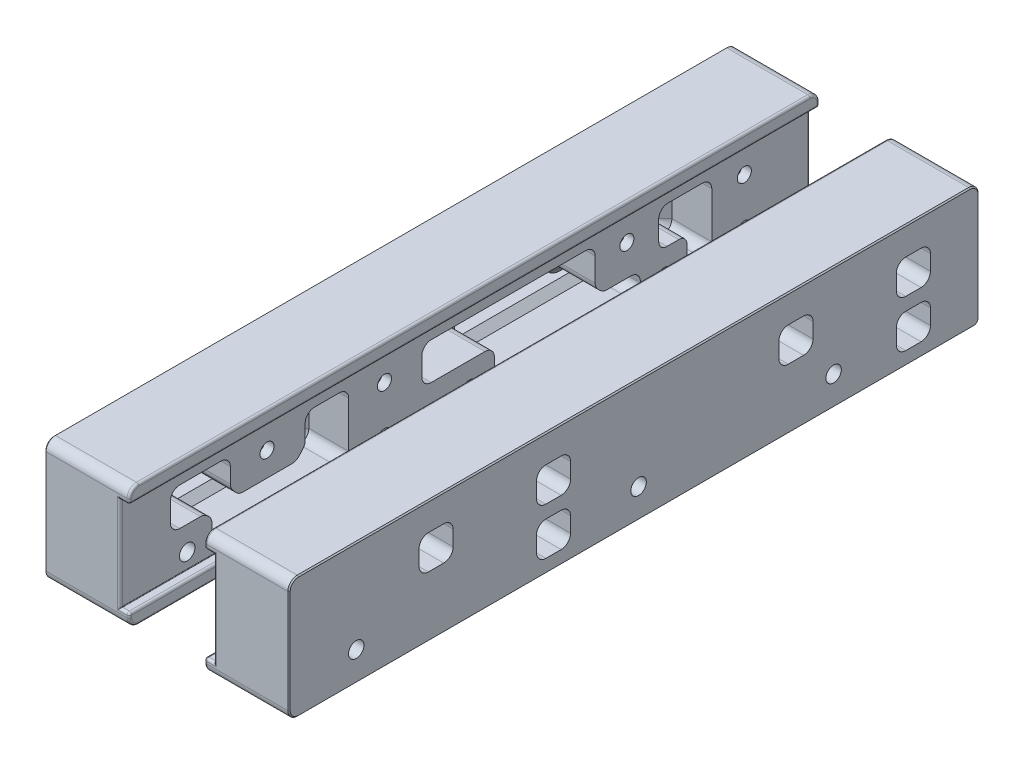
SolidWorks part; units mm, degrees
ref_plane "Спереди" through (0, 0, 0) normal (0, 0, 1) x (1, 0, 0)
ref_plane "Сверху" through (0, 0, 0) normal (0, 1, 0) x (1, 0, 0)
ref_plane "Справа" through (0, 0, 0) normal (1, 0, 0) x (0, 0, -1)
sketch "Эскиз2" plane through (0, 0, 0) normal (0, 0, 1) x (1, 0, 0)
  line L0 (0, 0) -> (22.3224, 0) construction
  line L1 (0, -10) -> (0, 10)
  line L2 (0, 10) -> (2, 10)
  line L3 (0, -10) -> (2, -10)
  line L4 (2, 10) -> (2, 13)
  line L5 (2, -10) -> (2, -13)
  line L6 (2, 13) -> (-15.99, 13)
  line L7 (2, -13) -> (-15.99, -13)
  line L8 (-15.99, 13) -> (-15.99, 0)
  line L9 (-15.99, 0) -> (-15.99, -13)
  line L10 (34.925, -34.3321) -> (34.925, 29.1374) construction
  point P6 (0, 0)
  dimension "D1" = 26
  dimension "D2" = 50.915
  dimension "D3" = 34.925
  dimension "D4" = 20
  dimension "D5" = 3
  dimension "D6" = 15.99
extrude "Бобышка-Вытянуть1" add sketch "Эскиз2" along normal blind 146.9
sketch "Эскиз3" plane through (0, 0, 0) normal (1, 0, 0) x (0, 0, -1)
  line L0 (0, 0) -> (12.8936, 0) construction
  line L1 (-14, 7.6777) -> (-14, -7.642) construction
  line L2 (-18.1695, 3.5) -> (16.6858, 3.5) construction
  line L3 (4.8407, -6.5) -> (24.6138, -6.5) construction
  line L4 (-146.9, -10) -> (0, -10) construction
  line L5 (-146.9, 10) -> (0, 10) construction
  line L6 (-146.9, 10) -> (0, 10) construction
  line L7 (-146.9, -10) -> (0, -10) construction
  line L8 (-90.6, 7.6777) -> (-90.6, -7.642) construction
  line L9 (0, -10) -> (0, 10) construction
  line L10 (-30.99, 25.1657) -> (-30.99, -20.7809) construction
  line L11 (-132.59, 25.1657) -> (-132.59, -20.7809) construction
  line L12 (-39, 0) -> (-39, 11.712) construction
  line L13 (6.8452, -6.75) -> (-42.5956, -6.75) construction
  line L14 (-146.9, -13) -> (0, -13) construction
  line L15 (-72.5, 25.1657) -> (-72.5, -20.7809) construction
  line L16 (-115.6, 0) -> (-115.6, 11.712) construction
  circle A0 centre (-14, 3.5) radius 1.5
  circle A1 centre (-14, -6.5) radius 1.5
  circle A2 centre (-90.6, 3.5) radius 1.5
  circle A3 centre (-90.6, -6.5) radius 1.5
  circle A4 centre (-30.99, -6.75) radius 1.65
  circle A5 centre (-132.59, -6.75) radius 1.65
  circle A6 centre (-72.5, -6.75) radius 1.65
  circle A7 centre (-39, 3.5) radius 1.5
  circle A8 centre (-115.6, 3.5) radius 1.5
  point P53 (0, 0)
  point P54 (0, 0)
  dimension "D8" = 90.6
  dimension "D9" = 30.99
  dimension "D11" = 41.51
  dimension "D13" = 25
  dimension "D1" = 14
  dimension "D2" = 3.5
  dimension "D3" = 3.5
  dimension "D4" = 6.5
  dimension "D5" = 6.5
  dimension "D6" = 10
  dimension "D7" = 10
  dimension "D10" = 6.25
  dimension "D12" = 101.6
  dimension "D14" = 25
extrude "Вырез-Вытянуть1" cut sketch "Эскиз3" against normal blind 2
sketch "Эскиз4" plane through (-15.99, 0, 0) normal (-1, 0, 0) x (0, 0, 1)
  line L1 (10.375, -0.125) -> (17.625, -0.125)
  line L2 (10.375, -0.125) -> (10.375, 7.125)
  line L3 (10.375, 7.125) -> (17.625, 7.125)
  line L4 (17.625, -0.125) -> (17.625, 7.125)
  line L5 (10.375, -0.125) -> (17.625, 7.125) construction
  line L6 (10.375, 7.125) -> (17.625, -0.125) construction
  line L11 (10.375, -10.125) -> (17.625, -10.125)
  line L12 (10.375, -10.125) -> (10.375, -2.875)
  line L13 (10.375, -2.875) -> (17.625, -2.875)
  line L14 (17.625, -10.125) -> (17.625, -2.875)
  line L15 (10.375, -10.125) -> (17.625, -2.875) construction
  line L16 (10.375, -2.875) -> (17.625, -10.125) construction
  line L17 (86.975, -0.125) -> (94.225, -0.125)
  line L18 (86.975, -0.125) -> (86.975, 7.125)
  line L19 (86.975, 7.125) -> (94.225, 7.125)
  line L20 (94.225, -0.125) -> (94.225, 7.125)
  line L21 (86.975, -0.125) -> (94.225, 7.125) construction
  line L22 (86.975, 7.125) -> (94.225, -0.125) construction
  line L23 (86.975, -10.125) -> (94.225, -10.125)
  line L24 (86.975, -10.125) -> (86.975, -2.875)
  line L25 (86.975, -2.875) -> (94.225, -2.875)
  line L26 (94.225, -10.125) -> (94.225, -2.875)
  line L27 (86.975, -10.125) -> (94.225, -2.875) construction
  line L28 (86.975, -2.875) -> (94.225, -10.125) construction
  line L29 (35.375, -0.125) -> (42.625, -0.125)
  line L30 (35.375, -0.125) -> (35.375, 7.125)
  line L31 (35.375, 7.125) -> (42.625, 7.125)
  line L32 (42.625, -0.125) -> (42.625, 7.125)
  line L33 (35.375, -0.125) -> (42.625, 7.125) construction
  line L34 (35.375, 7.125) -> (42.625, -0.125) construction
  line L35 (111.975, -0.125) -> (119.225, -0.125)
  line L36 (111.975, -0.125) -> (111.975, 7.125)
  line L37 (111.975, 7.125) -> (119.225, 7.125)
  line L38 (119.225, -0.125) -> (119.225, 7.125)
  line L39 (111.975, -0.125) -> (119.225, 7.125) construction
  line L40 (111.975, 7.125) -> (119.225, -0.125) construction
  circle A0 centre (90.6, -6.5) radius 1.5 construction
  circle A1 centre (90.6, 3.5) radius 1.5 construction
  circle A2 centre (14, -6.5) radius 1.5 construction
  circle A3 centre (14, 3.5) radius 1.5 construction
  circle A4 centre (90.6, -6.5) radius 1.5 construction
  circle A5 centre (90.6, 3.5) radius 1.5 construction
  circle A6 centre (14, -6.5) radius 1.5 construction
  circle A7 centre (14, 3.5) radius 1.5 construction
  circle A8 centre (115.6, 3.5) radius 1.5 construction
  circle A9 centre (39, 3.5) radius 1.5 construction
  circle A10 centre (115.6, 3.5) radius 1.5 construction
  circle A11 centre (39, 3.5) radius 1.5 construction
  dimension "D1" = 7.25
extrude "Вырез-Вытянуть2" cut sketch "Эскиз4" against normal offset from surface (13.79 mm away) 0.2
fillet "Скругление2" radius 2 24 edges at (-9.095, -0.125, 10.375) (-9.095, -0.125, 17.625) (-9.095, 7.125, 10.375) (-9.095, -10.125, 86.975) (-9.095, -10.125, 94.225) (-9.095, -2.875, 94.225) (-9.095, -2.875, 86.975) (-9.095, -10.125, 10.375) (-9.095, -10.125, 17.625) (-9.095, -2.875, 17.625) (-9.095, -2.875, 10.375) (-9.095, -0.125, 86.975) (-9.095, -0.125, 94.225) (-9.095, 7.125, 94.225) (-9.095, 7.125, 86.975) (-9.095, 7.125, 17.625) (-9.095, -0.125, 35.375) (-9.095, -0.125, 42.625) (-9.095, 7.125, 42.625) (-9.095, 7.125, 35.375) (-9.095, -0.125, 111.975) (-9.095, -0.125, 119.225) (-9.095, 7.125, 119.225) (-9.095, 7.125, 111.975)
sketch "Эскиз5" plane through (-15.99, 0, 0) normal (-1, 0, 0) x (0, 0, 1)
  circle A0 centre (30.99, -6.75) radius 1.65 construction
  circle A1 centre (72.5, -6.75) radius 1.65 construction
  circle A2 centre (132.59, -6.75) radius 1.65 construction
  circle A3 centre (30.99, -6.75) radius 1.65
  circle A4 centre (72.5, -6.75) radius 1.65
  circle A5 centre (132.59, -6.75) radius 1.65
extrude "Вырез-Вытянуть3" cut sketch "Эскиз5" against normal through all
sketch "Эскиз6" plane through (0, 0, 0) normal (1, 0, 0) x (0, 0, -1)
  line L0 (-136.1688, 6.3867) -> (-123.3982, 6.3867)
  line L1 (-98.2072, 6.3867) -> (-98.2072, -7.4091)
  line L2 (-98.2072, -7.4091) -> (-127.3311, -7.4091)
  line L3 (-127.3311, -7.4091) -> (-127.3311, -3.0996)
  line L4 (-129.0166, -1.6497) -> (-136.1688, -1.6497)
  line L5 (-136.1688, -1.6497) -> (-136.1688, 6.3867)
  line L6 (-82.6461, 6.3867) -> (-82.6461, -1.4975)
  line L9 (-77.7965, -1.4975) -> (-67.2015, -1.4975)
  line L10 (-67.2015, -1.4975) -> (-67.2015, -7.4091)
  line L11 (-67.2015, -7.4091) -> (-36.1358, -7.4091)
  line L12 (-36.1358, -7.4091) -> (-36.1358, -4.8542)
  line L13 (-31.1328, -1.4975) -> (-27.2462, -1.4975)
  line L14 (-26.1782, -2.3537) -> (-26.1782, -7.4091)
  line L15 (-26.1782, -7.4091) -> (-20.9241, -7.4091)
  line L16 (-20.9241, -7.4091) -> (-20.9241, 6.3867)
  line L17 (-20.9241, 6.3867) -> (-32.2251, 6.3867)
  line L18 (-45.7507, 6.3867) -> (-45.7507, -1.4975)
  line L19 (-44.0699, -3.0996) -> (-36.4696, -3.0996)
  line L20 (-45.7507, -1.4975) -> (-44.0699, -3.0996)
  line L22 (-32.2251, -0.6525) -> (-32.2251, 6.3867)
  line L23 (-27.2462, -1.4975) -> (-26.1782, -2.3537)
  line L24 (-32.2251, -0.6525) -> (-31.1328, -1.4975)
  line L25 (-45.7507, 6.3867) -> (-82.6461, 6.3867)
  line L29 (-123.3982, 6.3867) -> (-123.3982, 0.4203)
  line L30 (-121.6503, -1.6497) -> (-109.4147, -1.6497)
  line L31 (-107.4794, 0.4203) -> (-107.4794, 6.3867)
  line L32 (-107.4794, 6.3867) -> (-98.2072, 6.3867)
  line L34 (-127.3311, -3.0996) -> (-129.0166, -1.6497)
  line L35 (-121.6503, -1.6497) -> (-123.3982, 0.4203)
  line L36 (-107.4794, 0.4203) -> (-109.4147, -1.6497)
  line L37 (-77.7965, -1.4975) -> (-82.6461, -1.4975)
  line L40 (-36.1358, -4.8542) -> (-36.1358, -3.0996)
  line L41 (-36.1358, -3.0996) -> (-36.4696, -3.0996)
extrude "Вырез-Вытянуть4" cut sketch "Эскиз6" against normal offset from surface (9.99 mm away) 6
fillet "Скругление3" radius 2 30 edges at (-4.995, -1.4975, 67.2015) (-4.995, -7.4091, 67.2015) (-4.995, -7.4091, 36.1358) (-4.995, -7.4091, 26.1782) (-4.995, -7.4091, 20.9241) (-4.995, 6.3867, 20.9241) (-4.995, -7.4091, 127.3311) (-4.995, -7.4091, 98.2072) (-4.995, 6.3867, 136.1688) (-4.995, -1.6497, 136.1688) (-4.995, -1.6497, 129.0166) (-4.995, -3.0996, 127.3311) (-4.995, 6.3867, 98.2072) (-4.995, 6.3867, 107.4794) (-4.995, 0.4203, 107.4794) (-4.995, -1.6497, 109.4147) (-4.995, -1.6497, 121.6503) (-4.995, 0.4203, 123.3982) (-4.995, 6.3867, 123.3982) (-4.995, 6.3867, 32.2251) (-4.995, -2.3537, 26.1782) (-4.995, -1.4975, 27.2462) (-4.995, 6.3867, 82.6461) (-4.995, 6.3867, 45.7507) (-4.995, -1.4975, 45.7507) (-4.995, -3.0996, 44.0699) (-4.995, -1.4975, 82.6461) (-4.995, -0.6525, 32.2251) (-4.995, -1.4975, 31.1328) (-4.995, -3.0996, 36.1358)
fillet "Скругление4" radius 0.25 8 edges at (-15.99, 0, 146.9) (-15.99, -13, 73.45) (-15.99, 0, 0) (-15.99, 13, 73.45) (-6.995, 13, 146.9) (-6.995, -13, 146.9) (-6.995, -13, 0) (-6.995, 13, 0)
sketch "Эскиз9" plane through (0, 0, 0) normal (1, 0, 0) x (0, 0, -1)
  line L1 (-0.25, 13) -> (-146.65, 13) construction
  line L3 (-146.9, 12.75) -> (-146.9, -12.75) construction
  line L5 (-146.65, -13) -> (-0.25, -13) construction
  line L7 (0, -12.75) -> (0, 12.75) construction
  line L9 (-2, 13) -> (-144.9, 13)
  line L11 (-146.9, 11) -> (-146.9, -11)
  line L13 (-144.9, -13) -> (-1.1823, -13)
  line L15 (0, -11.8177) -> (0, 11)
  arc A0 (0, 11) -> (-2, 13) centre (-2, 11) ccw
  arc A1 (-1.1823, -13) -> (0, -11.8177) centre (-1.1823, -11.8177) ccw
  arc A2 (-146.9, -11) -> (-144.9, -13) centre (-144.9, -11) ccw
  arc A3 (-144.9, 13) -> (-146.9, 11) centre (-144.9, 11) ccw
extrude "Вырез-Вытянуть7" cut sketch "Эскиз9" against normal through all both and the other way through all flip side to cut
fillet "Скругление5" radius 0.5 18 edges at (2, -10, 73.45) (2, -10.9089, 0) (2, -13, 73.0411) (2, -10.5, 146.9) (2, 10.5, 0) (2, 10, 73.45) (2, 10.5, 146.9) (2, 13, 73.45) (1, 10, 146.9) (1, -10, 146.9) (1, -10, 0) (1, 10, 0) (0, 0, 0) (0, 0, 146.9) (2, -12.4142, 146.3142) (2, -12.6537, 0.3463) (2, 12.4142, 0.5858) (2, 12.4142, 146.3142)
fillet "Скругление6" radius 0.1 6 edges at (-0.1464, 10.1464, 146.7536) (-0.1464, 10.1464, 0.1464) (-0.1464, -10.1464, 146.7536) (-0.1464, -10.1464, 0.1464) (0, 10, 73.45) (0, -10, 73.45)
fillet "Скругление7" radius 1.5 58 edges at (-9.99, 6.3867, 26.5746) (-9.99, 5.8009, 21.5099) (-9.99, -0.5112, 20.9241) (-9.99, -6.8233, 21.5099) (-9.99, -7.4091, 23.5512) (-9.99, -6.8233, 25.5925) (-9.99, -4.3614, 26.1782) (-9.99, -1.4975, 29.1992) (-9.99, -5.2543, 36.1358) (-9.99, -6.8233, 36.7216) (-9.99, -7.4091, 51.6686) (-9.99, -6.8233, 66.6157) (-9.99, -4.4533, 67.2015) (-9.99, -2.0833, 67.7872) (-9.99, -1.4975, 74.9238) (-9.99, 2.4446, 82.6461) (-9.99, -1.6497, 131.9637) (-9.99, -1.0639, 135.583) (-9.99, 2.3685, 136.1688) (-9.99, 5.8009, 135.583) (-9.99, 6.3867, 129.7835) (-9.99, -0.5112, 98.2072) (-9.99, -6.8233, 98.793) (-9.99, -7.4091, 112.7692) (-9.99, -6.8233, 126.7453) (-9.99, -4.7132, 127.3311) (-9.99, 5.8009, 82.0604) (-9.99, 6.3867, 64.1984) (-9.99, 5.8009, 46.3365) (-9.99, 1.8729, 45.7507) (-9.99, -1.4283, 45.5891) (-9.99, -2.3179, 44.89) (-9.99, -2.9564, 44.0126) (-9.99, -3.0996, 40.7026) (-9.99, -3.6854, 36.7216) (-9.99, -0.9117, 82.0604) (-9.99, 5.8009, 123.984) (-9.99, 2.7693, 123.3982) (-9.99, 0.4648, 123.2766) (-9.99, -0.5393, 122.5879) (-9.99, -1.4636, 121.5639) (-9.99, -1.6497, 115.5021) (-9.99, -1.4843, 109.4864) (-9.99, -0.5859, 108.4201) (-9.99, 0.4754, 107.6191) (-9.99, 2.7982, 107.4794) (-9.99, 5.8009, 106.8936) (-9.99, 6.3867, 102.8433) (-9.99, 5.8009, 98.793) (-9.99, -3.1832, 127.5134) (-9.99, -2.3173, 128.2406) (-9.99, -1.7745, 129.063) (-9.99, 5.8009, 31.6393) (-9.99, -2.5151, 26.3446) (-9.99, -1.5875, 27.3558) (-9.99, -1.4119, 31.0285) (-9.99, -0.4879, 32.0507) (-9.99, 2.3578, 32.2251)
sketch "Эскиз7" plane through (-9.99, 0, 0) normal (1, 0, 0) x (0, 0, -1)
  line L36 (-22.9241, 4.8867) -> (-30.2251, 4.8867) construction
  line L37 (-30.7251, 4.3867) -> (-30.7251, 0.3289) construction
  line L38 (-30.4495, 0.0025) -> (-27.9489, 0.0025) construction
  line L39 (-24.6782, -3.3137) -> (-24.6782, -5.4091) construction
  line L40 (-24.1782, -5.9091) -> (-22.9241, -5.9091) construction
  line L41 (-22.4241, -5.4091) -> (-22.4241, 4.3867) construction
  line L42 (-47.7507, 4.8867) -> (-80.6461, 4.8867) construction
  line L43 (-81.1461, 4.3867) -> (-81.1461, 0.5025) construction
  line L44 (-80.6461, 0.0025) -> (-69.2015, 0.0025) construction
  line L45 (-65.7015, -3.4975) -> (-65.7015, -5.4091) construction
  line L46 (-65.2015, -5.9091) -> (-38.1358, -5.9091) construction
  line L47 (-37.6358, -5.4091) -> (-37.6358, -5.0996) construction
  line L48 (-38.1358, -4.5996) -> (-43.2694, -4.5996) construction
  line L49 (-124.8982, 1.1518) -> (-124.8982, 4.3867)
  line L50 (-125.3982, 4.8867) -> (-134.1688, 4.8867)
  line L51 (-134.6688, 4.3867) -> (-134.6688, 0.3503)
  line L52 (-134.1688, -0.1497) -> (-129.7585, -0.1497)
  line L53 (-127.476, -0.9963) -> (-127.0487, -1.3639)
  line L54 (-125.8311, -4.0173) -> (-125.8311, -5.4091)
  line L55 (-125.3311, -5.9091) -> (-100.2072, -5.9091)
  line L56 (-99.7072, -5.4091) -> (-99.7072, 4.3867)
  line L57 (-100.2072, 4.8867) -> (-105.4794, 4.8867)
  line L58 (-105.9794, 4.3867) -> (-105.9794, 1.2096)
  line L59 (-106.9227, -1.1806) -> (-107.7261, -2.0399)
  line L60 (-110.2828, -3.1497) -> (-120.7215, -3.1497)
  line L61 (-123.3956, -1.9078) -> (-124.0724, -1.1063)
  line L62 (-124.8982, 1.1518) -> (-124.8982, 4.3867)
  line L63 (-125.3982, 4.8867) -> (-134.1688, 4.8867)
  line L64 (-134.6688, 4.3867) -> (-134.6688, 0.3503)
  line L65 (-134.1688, -0.1497) -> (-129.7585, -0.1497)
  line L66 (-127.476, -0.9963) -> (-127.0487, -1.3639)
  line L67 (-125.8311, -4.0173) -> (-125.8311, -5.4091)
  line L68 (-125.3311, -5.9091) -> (-100.2072, -5.9091)
  line L69 (-99.7072, -5.4091) -> (-99.7072, 4.3867)
  line L70 (-100.2072, 4.8867) -> (-105.4794, 4.8867)
  line L71 (-105.9794, 4.3867) -> (-105.9794, 1.2096)
  line L72 (-106.9227, -1.1806) -> (-107.7261, -2.0399)
  line L73 (-110.2828, -3.1497) -> (-120.7215, -3.1497)
  line L74 (-123.3956, -1.9078) -> (-124.0724, -1.1063)
  line L75 (-45.6843, -3.633) -> (-46.1655, -3.1743) construction
  line L76 (-47.2507, -0.6409) -> (-47.2507, 4.3867) construction
  line L77 (-22.9241, 4.8867) -> (-30.2251, 4.8867)
  line L78 (-30.7251, 4.3867) -> (-30.7251, 0.3289)
  line L79 (-30.4495, 0.0025) -> (-27.9489, 0.0025)
  line L80 (-24.6782, -3.3137) -> (-24.6782, -5.4091)
  line L81 (-24.1782, -5.9091) -> (-22.9241, -5.9091)
  line L82 (-22.4241, -5.4091) -> (-22.4241, 4.3867)
  line L83 (-47.7507, 4.8867) -> (-80.6461, 4.8867)
  line L84 (-81.1461, 4.3867) -> (-81.1461, 0.5025)
  line L85 (-80.6461, 0.0025) -> (-69.2015, 0.0025)
  line L86 (-65.7015, -3.4975) -> (-65.7015, -5.4091)
  line L87 (-65.2015, -5.9091) -> (-38.1358, -5.9091)
  line L88 (-37.6358, -5.4091) -> (-37.6358, -5.0996)
  line L89 (-38.1358, -4.5996) -> (-43.2694, -4.5996)
  line L90 (-45.6843, -3.633) -> (-46.1655, -3.1743)
  line L91 (-47.2507, -0.6409) -> (-47.2507, 4.3867)
  arc A10 (-30.2251, 4.8867) -> (-30.7251, 4.3867) centre (-30.2251, 4.3867) ccw construction
  arc A11 (-30.7251, 0.3289) -> (-30.6307, 0.0365) centre (-30.2251, 0.3289) ccw construction
  arc A12 (-30.6307, 0.0365) -> (-30.4495, 0.0025) centre (-30.4495, 0.5025) ccw construction
  arc A13 (-25.8762, -0.6772) -> (-27.9489, 0.0025) centre (-27.9489, -3.4975) ccw construction
  arc A14 (-24.6782, -3.3137) -> (-25.8762, -0.6772) centre (-28.1782, -3.3137) ccw construction
  arc A15 (-24.6782, -5.4091) -> (-24.1782, -5.9091) centre (-24.1782, -5.4091) ccw construction
  arc A16 (-127.476, -0.9963) -> (-129.7585, -0.1497) centre (-129.7585, -3.6497) ccw
  arc A17 (-125.8311, -4.0173) -> (-127.0487, -1.3639) centre (-129.3311, -4.0173) ccw
  arc A18 (-106.9227, -1.1806) -> (-105.9794, 1.2096) centre (-109.4794, 1.2096) ccw
  arc A19 (-110.2828, -3.1497) -> (-107.7261, -2.0399) centre (-110.2828, 0.3503) ccw
  arc A20 (-123.3956, -1.9078) -> (-120.7215, -3.1497) centre (-120.7215, 0.3503) ccw
  arc A21 (-124.8982, 1.1518) -> (-124.0724, -1.1063) centre (-121.3982, 1.1518) ccw
  arc A22 (-127.476, -0.9963) -> (-129.7585, -0.1497) centre (-129.7585, -3.6497) ccw
  arc A23 (-125.8311, -4.0173) -> (-127.0487, -1.3639) centre (-129.3311, -4.0173) ccw
  arc A24 (-106.9227, -1.1806) -> (-105.9794, 1.2096) centre (-109.4794, 1.2096) ccw
  arc A25 (-110.2828, -3.1497) -> (-107.7261, -2.0399) centre (-110.2828, 0.3503) ccw
  arc A26 (-123.3956, -1.9078) -> (-120.7215, -3.1497) centre (-120.7215, 0.3503) ccw
  arc A27 (-124.8982, 1.1518) -> (-124.0724, -1.1063) centre (-121.3982, 1.1518) ccw
  arc A28 (-22.9241, -5.9091) -> (-22.4241, -5.4091) centre (-22.9241, -5.4091) ccw construction
  arc A29 (-22.4241, 4.3867) -> (-22.9241, 4.8867) centre (-22.9241, 4.3867) ccw construction
  arc A30 (-80.6461, 4.8867) -> (-81.1461, 4.3867) centre (-80.6461, 4.3867) ccw construction
  arc A31 (-81.1461, 0.5025) -> (-80.6461, 0.0025) centre (-80.6461, 0.5025) ccw construction
  arc A32 (-65.7015, -3.4975) -> (-69.2015, 0.0025) centre (-69.2015, -3.4975) ccw construction
  arc A33 (-65.7015, -5.4091) -> (-65.2015, -5.9091) centre (-65.2015, -5.4091) ccw construction
  arc A34 (-38.1358, -5.9091) -> (-37.6358, -5.4091) centre (-38.1358, -5.4091) ccw construction
  arc A35 (-134.1688, 4.8867) -> (-134.6688, 4.3867) centre (-134.1688, 4.3867) ccw
  arc A36 (-134.1688, 4.8867) -> (-134.6688, 4.3867) centre (-134.1688, 4.3867) ccw
  arc A37 (-134.6688, 0.3503) -> (-134.1688, -0.1497) centre (-134.1688, 0.3503) ccw
  arc A38 (-134.6688, 0.3503) -> (-134.1688, -0.1497) centre (-134.1688, 0.3503) ccw
  arc A39 (-125.8311, -5.4091) -> (-125.3311, -5.9091) centre (-125.3311, -5.4091) ccw
  arc A40 (-125.8311, -5.4091) -> (-125.3311, -5.9091) centre (-125.3311, -5.4091) ccw
  arc A41 (-100.2072, -5.9091) -> (-99.7072, -5.4091) centre (-100.2072, -5.4091) ccw
  arc A42 (-100.2072, -5.9091) -> (-99.7072, -5.4091) centre (-100.2072, -5.4091) ccw
  arc A43 (-99.7072, 4.3867) -> (-100.2072, 4.8867) centre (-100.2072, 4.3867) ccw
  arc A44 (-99.7072, 4.3867) -> (-100.2072, 4.8867) centre (-100.2072, 4.3867) ccw
  arc A45 (-105.4794, 4.8867) -> (-105.9794, 4.3867) centre (-105.4794, 4.3867) ccw
  arc A46 (-105.4794, 4.8867) -> (-105.9794, 4.3867) centre (-105.4794, 4.3867) ccw
  arc A47 (-124.8982, 4.3867) -> (-125.3982, 4.8867) centre (-125.3982, 4.3867) ccw
  arc A48 (-124.8982, 4.3867) -> (-125.3982, 4.8867) centre (-125.3982, 4.3867) ccw
  arc A49 (-37.6358, -5.0996) -> (-38.1358, -4.5996) centre (-38.1358, -5.0996) ccw construction
  arc A50 (-45.6843, -3.633) -> (-43.2694, -4.5996) centre (-43.2694, -1.0996) ccw construction
  arc A51 (-47.2507, -0.6409) -> (-46.1655, -3.1743) centre (-43.7507, -0.6409) ccw construction
  arc A52 (-47.2507, 4.3867) -> (-47.7507, 4.8867) centre (-47.7507, 4.3867) ccw construction
  arc A53 (-30.2251, 4.8867) -> (-30.7251, 4.3867) centre (-30.2251, 4.3867) ccw
  arc A54 (-30.7251, 0.3289) -> (-30.6307, 0.0365) centre (-30.2251, 0.3289) ccw
  arc A55 (-30.6307, 0.0365) -> (-30.4495, 0.0025) centre (-30.4495, 0.5025) ccw
  arc A56 (-25.8762, -0.6772) -> (-27.9489, 0.0025) centre (-27.9489, -3.4975) ccw
  arc A57 (-24.6782, -3.3137) -> (-25.8762, -0.6772) centre (-28.1782, -3.3137) ccw
  arc A58 (-24.6782, -5.4091) -> (-24.1782, -5.9091) centre (-24.1782, -5.4091) ccw
  arc A59 (-22.9241, -5.9091) -> (-22.4241, -5.4091) centre (-22.9241, -5.4091) ccw
  arc A60 (-22.4241, 4.3867) -> (-22.9241, 4.8867) centre (-22.9241, 4.3867) ccw
  arc A61 (-80.6461, 4.8867) -> (-81.1461, 4.3867) centre (-80.6461, 4.3867) ccw
  arc A62 (-81.1461, 0.5025) -> (-80.6461, 0.0025) centre (-80.6461, 0.5025) ccw
  arc A63 (-65.7015, -3.4975) -> (-69.2015, 0.0025) centre (-69.2015, -3.4975) ccw
  arc A64 (-65.7015, -5.4091) -> (-65.2015, -5.9091) centre (-65.2015, -5.4091) ccw
  arc A65 (-38.1358, -5.9091) -> (-37.6358, -5.4091) centre (-38.1358, -5.4091) ccw
  arc A66 (-37.6358, -5.0996) -> (-38.1358, -4.5996) centre (-38.1358, -5.0996) ccw
  arc A67 (-45.6843, -3.633) -> (-43.2694, -4.5996) centre (-43.2694, -1.0996) ccw
  arc A68 (-47.2507, -0.6409) -> (-46.1655, -3.1743) centre (-43.7507, -0.6409) ccw
  arc A69 (-47.2507, 4.3867) -> (-47.7507, 4.8867) centre (-47.7507, 4.3867) ccw
  dimension "D1" = 0
extrude "Вырез-Вытянуть5" cut sketch "Эскиз7" against normal offset from surface (3 mm away) 3
fillet "Скругление8" radius 0.25 4 edges at (-15.99, -12.4142, 146.3142) (-15.99, 12.4142, 146.3142) (-15.99, 12.4142, 0.5858) (-15.99, -12.6537, 0.3463)
ref_plane "Плоскость1" through (10, 0, 0) normal (1, 0, 0) x (0, 0, -1)
mirror "Зеркальное отражение2" about plane through (10, 0, 0) normal (1, 0, 0)
